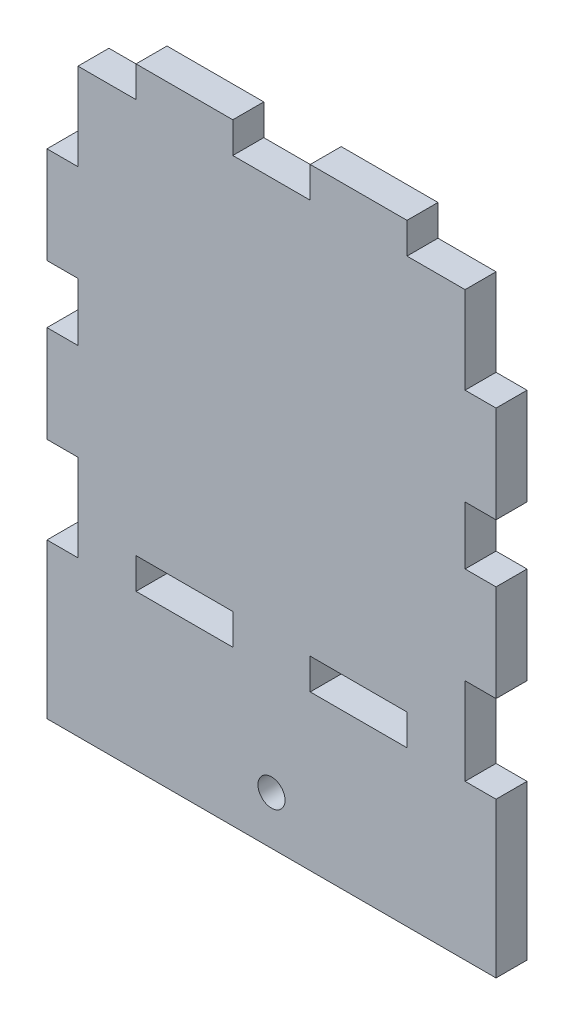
SolidWorks part; units mm, degrees
ref_plane "Front Plane" through (0, 0, 0) normal (0, 0, 1) x (1, 0, 0)
ref_plane "Top Plane" through (0, 0, 0) normal (0, 1, 0) x (1, 0, 0)
ref_plane "Right Plane" through (0, 0, 0) normal (1, 0, 0) x (0, 0, -1)
sketch "Sketch1" plane through (0, 0, 0) normal (0, 0, 1) x (1, 0, 0)
  line L0 (200, 300) -> (200, 255) construction
  line L1 (0, 0) -> (200, 0)
  line L2 (100, 300) -> (100, -84.8333) construction
  line L3 (216, 255) -> (216, 440.8702) construction
  line L4 (200, 0) -> (200, 300)
  line L5 (0, 300) -> (200, 300)
  line L6 (200, 255) -> (216, 255)
  line L7 (200, 255) -> (200, 205)
  line L8 (200, 205) -> (216, 205)
  line L9 (216, 255) -> (216, 205)
  line L10 (-16, 175) -> (-16, 125)
  line L11 (200, 175) -> (216, 175)
  line L12 (200, 175) -> (200, 125)
  line L13 (200, 125) -> (216, 125)
  line L14 (216, 175) -> (216, 125)
  line L15 (0, 125) -> (-16, 125)
  line L16 (0, 175) -> (0, 125)
  line L17 (0, 175) -> (-16, 175)
  line L18 (-16, 255) -> (-16, 205)
  line L19 (0, 205) -> (-16, 205)
  line L20 (0, 255) -> (0, 205)
  line L21 (0, 255) -> (-16, 255)
  line L22 (100, 0) -> (100, 18) construction
  line L23 (0, 300) -> (0, 0)
  line L24 (-16, 0) -> (-16, 80)
  line L25 (200, 0) -> (216, 0)
  line L26 (200, 0) -> (200, 80)
  line L27 (200, 80) -> (216, 80)
  line L28 (216, 0) -> (216, 80)
  line L29 (0, 80) -> (-16, 80)
  line L30 (0, 0) -> (0, 80)
  line L31 (0, 0) -> (-16, 0)
  line L32 (100, 300) -> (100, 389.9343) construction
  line L33 (80, 300) -> (80, 316)
  line L34 (170, 300) -> (120, 300)
  line L35 (170, 300) -> (170, 316)
  line L36 (170, 316) -> (120, 316)
  line L37 (120, 300) -> (120, 316)
  line L38 (30, 316) -> (80, 316)
  line L39 (30, 300) -> (30, 316)
  line L40 (30, 300) -> (80, 300)
  line L42 (80, 80) -> (80, 96)
  line L43 (170, 80) -> (120, 80)
  line L44 (170, 80) -> (170, 96)
  line L45 (170, 96) -> (120, 96)
  line L46 (120, 80) -> (120, 96)
  line L47 (30, 96) -> (80, 96)
  line L48 (30, 80) -> (30, 96)
  line L49 (30, 80) -> (80, 80)
  circle A0 centre (100, 25) radius 7
extrude "Boss-Extrude1" add sketch "Sketch1" against normal blind 16
equation "\"thk\"= 16mm"
equation "\"D3@Sketch1\"=\"thk\""
equation "\"D6@Sketch1\"=\"thk\""
equation "\"D1@Boss-Extrude1\"=\"thk\""
equation "\"D19@Sketch1\"=\"thk\"+2"
equation "\"D8@Sketch1\"=\"thk\""
equation "\"D12@Sketch1\"=\"thk\""
equation "\"D14@Sketch1\"=\"thk\""
